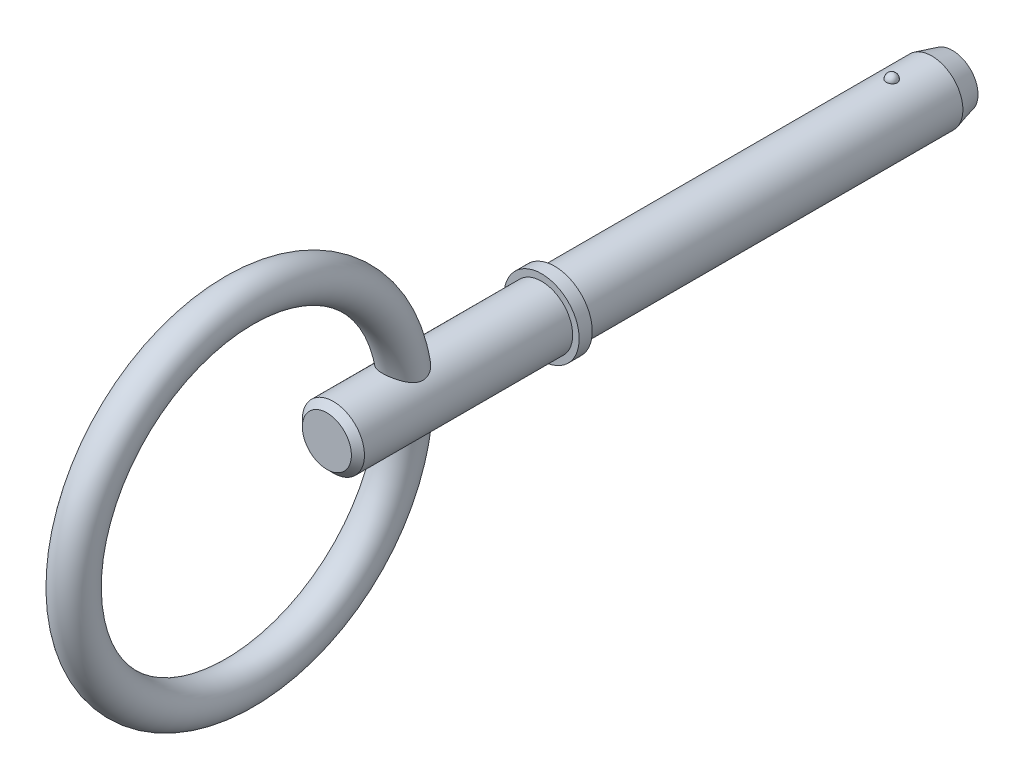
SolidWorks part; units mm, degrees
ref_plane "Front Plane" through (0, 0, 0) normal (0, 0, 1) x (1, 0, 0)
ref_plane "Top Plane" through (0, 0, 0) normal (0, 1, 0) x (1, 0, 0)
ref_plane "Right Plane" through (0, 0, 0) normal (1, 0, 0) x (0, 0, -1)
sketch "Sketch2" plane through (0, 0, 0) normal (0, 0, 1) x (1, 0, 0)
  circle A0 centre (0, 0) radius 2.38
  point P3 (0, 2.38)
  dimension "D1" = 4.76
extrude "Boss-Extrude1" add sketch "Sketch2" along normal blind 25.4
sketch "Sketch3" plane through (0, 0, 0) normal (0, 0, -1) x (-1, 0, 0)
  circle A0 centre (0, 0) radius 2.38
  dimension "D1" = 4.76
extrude "Boss-Extrude2" add sketch "Sketch3" along normal blind 5.08
chamfer "Chamfer1" distance 1.586 angle 15 1 edges at (-2.38, 0, -5.08)
sketch "Sketch18" plane through (0, 0, 0) normal (1, 0, 0) x (0, 0, -1)
  line L0 (3.494, 2.38) -> (-25.4, 2.38) construction
  line L1 (0.42, 2.8) -> (0.42, 1.96)
  line L2 (-25.4, -2.38) -> (3.494, -2.38) construction
  arc A0 (0.42, 2.8) -> (0.42, 1.96) centre (0.42, 2.38) ccw
  point P4 (0, 2.38)
  dimension "D1" = 5.18
revolve "Revolve1" add sketch "Sketch18" angle 360 about L1
sketch "Sketch19" plane through (0, 0, 0) normal (1, 0, 0) x (0, 0, -1)
  line L0 (-33.7288, 0) -> (-46.4542, 0) construction
sketch "Sketch20" plane through (0, 0, 0) normal (1, 0, 0) x (0, 0, -1)
  line L0 (-25.4, 0) -> (-25.4, 2.88)
  line L1 (-25.4, 2.38) -> (-25.4, -2.38) construction
  line L2 (-25.4, 2.88) -> (-26.4, 2.88)
  line L3 (-26.4, 2.88) -> (-26.4, 0)
  line L4 (-33.7288, 0) -> (-46.4542, 0) construction
  line L5 (-26.4, 0) -> (-25.4, 0)
  dimension "D1" = 2.88
  dimension "D2" = 1
revolve "Revolve2" add sketch "Sketch20" angle 360 about L0
sketch "Sketch21" plane through (0, 0, 25.4) normal (0, 0, -1) x (-1, 0, 0)
  circle A0 centre (0, 0) radius 2.38
  dimension "D1" = 4.76
extrude "Boss-Extrude3" add sketch "Sketch21" against normal blind 17.45
chamfer "Chamfer2" distance 0.5 angle 45 1 edges at (-2.38, 0, 42.85)
sketch "Sketch23" plane through (0, 0, 0) normal (1, 0, 0) x (0, 0, -1)
  line L0 (-42.85, 1.88) -> (-42.85, -1.88) construction
  circle A0 centre (-49.55, 0) radius 12.7
  point P2 (-36.85, 0)
  dimension "D1" = 25.4
  dimension "D2" = 6
sketch "Sketch24" plane through (0, 0, 0) normal (0, 1, 0) x (1, 0, 0)
  circle A0 centre (0, -36.85) radius 1.5
  dimension "D1" = 3
sweep "Sweep1" add profiles "Sketch24" path "Sketch23"
